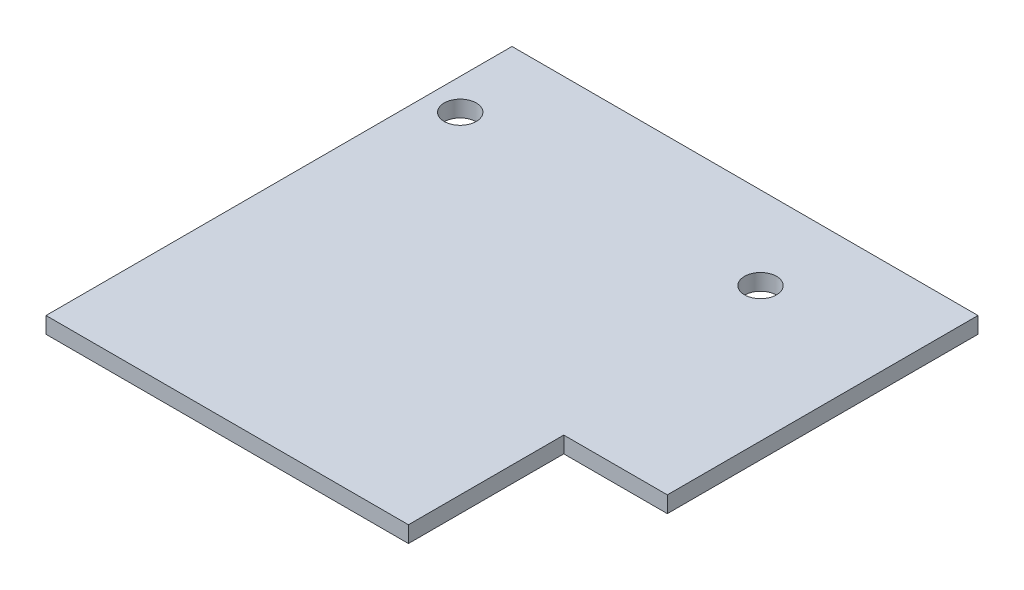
SolidWorks part; units mm, degrees
ref_plane "Front Plane" through (0, 0, 0) normal (0, 0, 1) x (1, 0, 0)
ref_plane "Top Plane" through (0, 0, 0) normal (0, 1, 0) x (1, 0, 0)
ref_plane "Right Plane" through (0, 0, 0) normal (1, 0, 0) x (0, 0, -1)
sketch "Sketch2" plane through (0, 0, 0) normal (1, 0, 0) x (0, 0, -1)
  line L1 (0, 0) -> (45, 0)
  line L2 (0, 0) -> (0, 1.5748)
  line L3 (0, 1.5748) -> (45, 1.5748)
  line L4 (45, 0) -> (45, 1.5748)
  dimension "D1" = 1.5748
  dimension "D2" = 45
extrude "Boss-Extrude2" add sketch "Sketch2" along normal mid plane 35
hole_wizard "Ø3.1 (3.1) Diameter Hole1" positions "Sketch4" profile "Sketch3" hole size "Ø3.1" standard "ANSI Metric"
sketch "Sketch4" plane through (0, 1.5748, 0) normal (0, 1, 0) x (1, 0, 0)
  line L0 (-14.5, 37) -> (14.5, 37) construction
  line L1 (14.5, 37) -> (17.5, 37) construction
  line L2 (17.5, 45) -> (17.5, 0) construction
  line L4 (-14.5, 37) -> (-17.5, 37) construction
  line L5 (-17.5, 45) -> (-17.5, 0) construction
  line L7 (17.5, 45) -> (-17.5, 45) construction
  point P0 (-14.5, 37)
  point P2 (14.5, 37)
  dimension "D1" = 3
  dimension "D2" = 8
sketch "Sketch3" plane through (-14.5, 1.5748, -37) normal (1, 0, 0) x (0, 0, 1)
  line L0 (0, 0) -> (0, 1.5748)
  line L1 (0, 1.5748) -> (1.55, 1.5748)
  line L2 (1.55, 1.5748) -> (1.55, 0)
  line L5 (1.55, 0) -> (0, 0)
  line L11 (0, -6.35) -> (0, 107.95) construction
  dimension "Thru Hole Dia." = 3.1
  dimension "Thru Hole Depth" = 1.5748
sketch "Sketch5" plane through (17.5, 0, 0) normal (1, 0, 0) x (0, 0, -1)
  line L0 (45, 1.5748) -> (0, 1.5748) construction
  line L1 (45, 0) -> (15, 0)
  line L2 (45, 0) -> (45, 1.5748)
  line L3 (45, 1.5748) -> (15, 1.5748)
  line L4 (15, 0) -> (15, 1.5748)
  dimension "D1" = 30
extrude "Boss-Extrude3" add sketch "Sketch5" along normal blind 10
